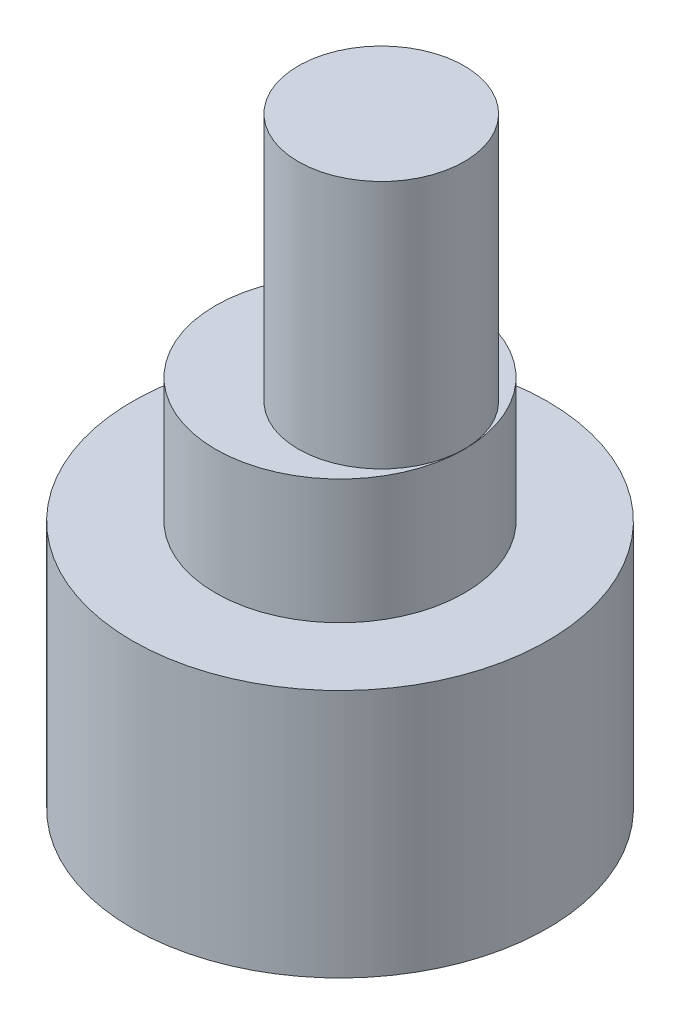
SolidWorks part; units mm, degrees
ref_plane "Front Plane" through (0, 0, 0) normal (0, 0, 1) x (1, 0, 0)
ref_plane "Top Plane" through (0, 0, 0) normal (0, 1, 0) x (1, 0, 0)
ref_plane "Right Plane" through (0, 0, 0) normal (1, 0, 0) x (0, 0, -1)
sketch "Sketch1" plane through (0, 0, 0) normal (0, 1, 0) x (1, 0, 0)
  circle A0 centre (0, 0) radius 1.5
  dimension "D1" = 3
extrude "Boss-Extrude1" add sketch "Sketch1" along normal blind 4.5
sketch "Sketch2" plane through (0, 4.5, 0) normal (0, 1, 0) x (1, 0, 0)
  line L0 (0, 0) -> (0.4974, 0) construction
  circle A0 centre (0.4974, 0) radius 1
  dimension "D1" = 2
  dimension "D2" = 0.4974
extrude "Boss-Extrude2" add sketch "Sketch2" along normal blind 3
sketch "Sketch3" plane through (0, 0, 0) normal (0, -1, 0) x (1, 0, 0)
  circle A0 centre (0, 0) radius 2.5
  dimension "D1" = 5
extrude "Boss-Extrude3" add sketch "Sketch3" against normal blind 3
